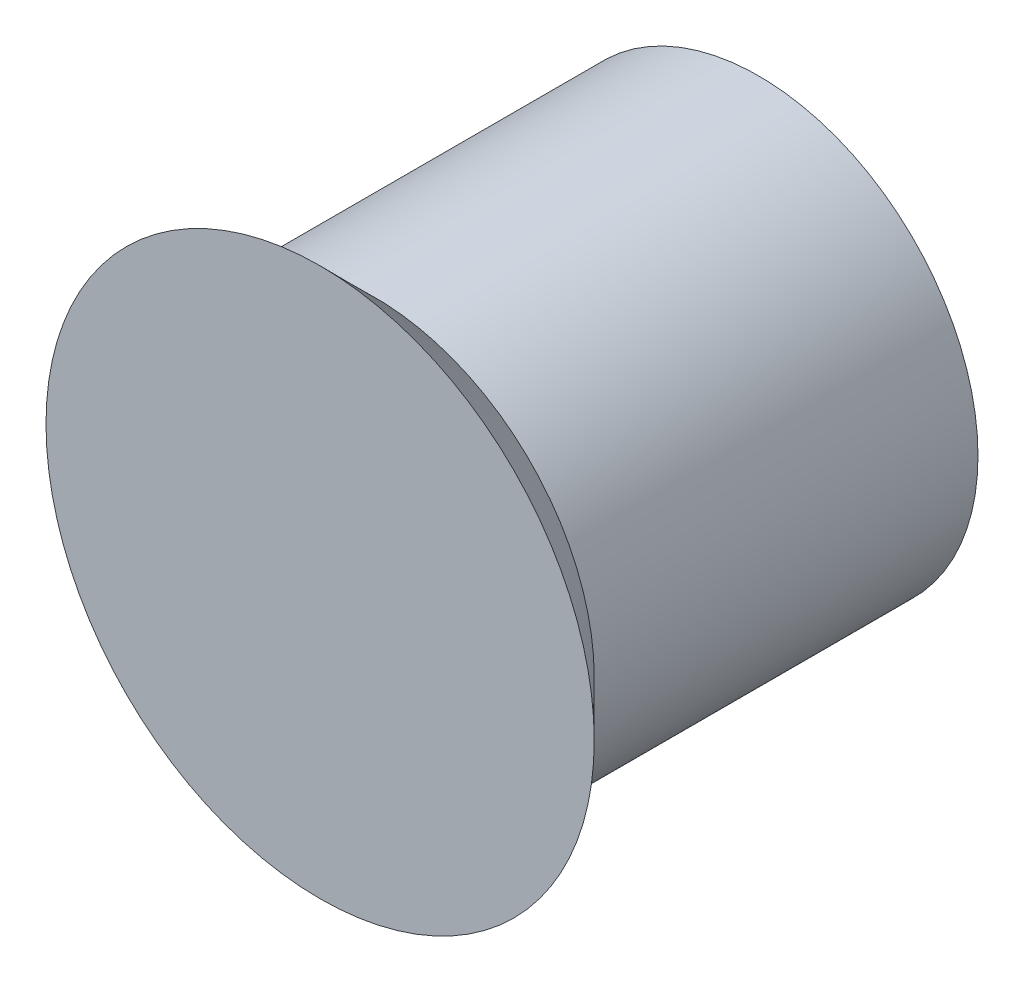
SolidWorks part; units mm, degrees
ref_plane "Ön Düzlem" through (0, 0, 0) normal (0, 0, 1) x (1, 0, 0)
ref_plane "Üst Düzlem" through (0, 0, 0) normal (0, 1, 0) x (1, 0, 0)
ref_plane "Sağ Düzlem" through (0, 0, 0) normal (1, 0, 0) x (0, 0, -1)
sketch "Çizim1" plane through (0, 0, 0) normal (0, 0, 1) x (1, 0, 0)
  circle A0 centre (0, 0) radius 4
  dimension "D1" = 8
extrude "Yükseklik-Ekstrüzyon1" add sketch "Çizim1" along normal blind 7
sketch "Çizim2" plane through (0, 0, 7) normal (0, 0, 1) x (1, 0, 0)
  circle A0 centre (0, 0) radius 4
extrude "Yükseklik-Ekstrüzyon2" add sketch "Çizim2" along normal blind 1 draft 45
